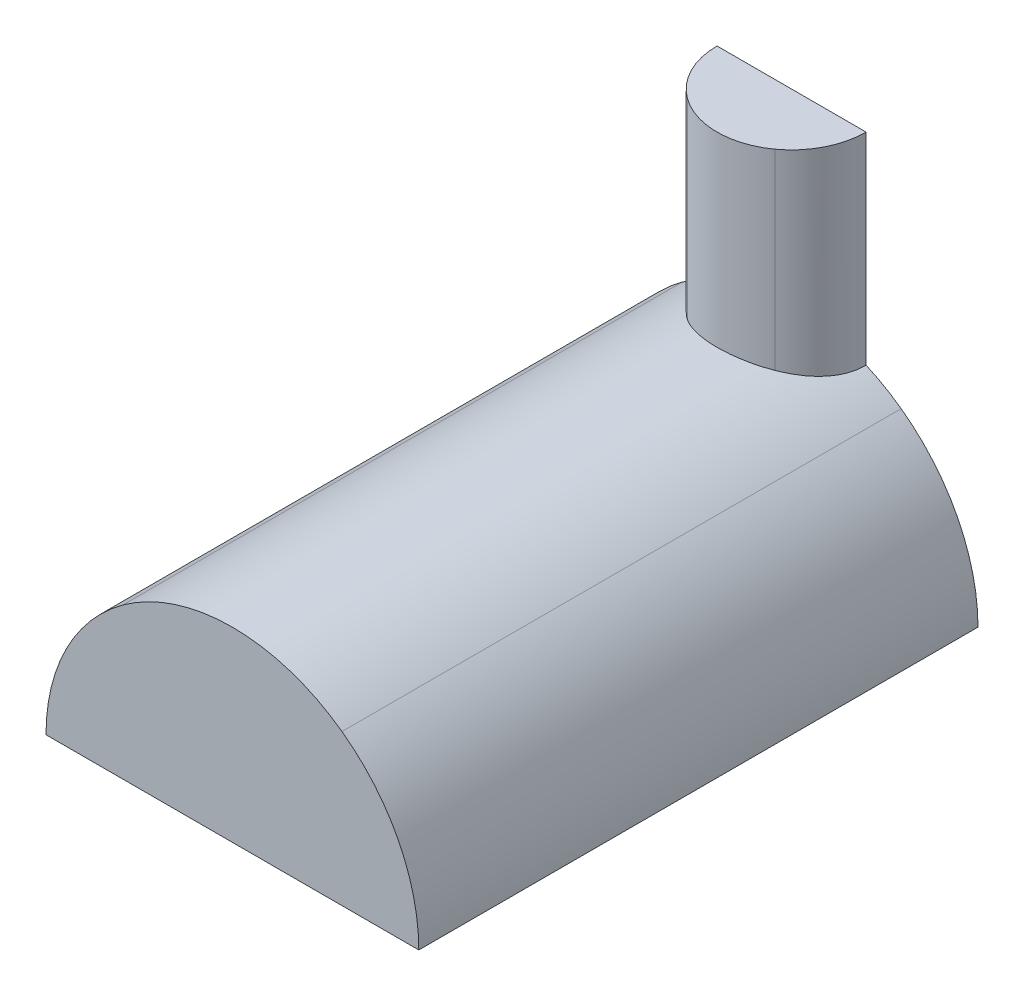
SolidWorks part; units mm, degrees
ref_plane "Front Plane" through (0, 0, 0) normal (0, 0, 1) x (1, 0, 0)
ref_plane "Top Plane" through (0, 0, 0) normal (0, 1, 0) x (1, 0, 0)
ref_plane "Right Plane" through (0, 0, 0) normal (1, 0, 0) x (0, 0, -1)
sketch "Sketch1" plane through (0, 0, 0) normal (0, 0, 1) x (1, 0, 0)
  line L0 (-1270, 0) -> (1270, 0)
  arc A0 (1270, 0) -> (-1270, 0) centre (0, 0) ccw
  dimension "D1" = 2540
extrude "Boss-Extrude1" add sketch "Sketch1" along normal blind 3810
sketch "Sketch2" plane through (0, 0, 0) normal (0, -1, 0) x (1, 0, 0)
  line L0 (-1270, 0) -> (1270, 0) construction
  line L1 (508, 0) -> (-508, 0)
  arc A0 (508, 0) -> (-508, 0) centre (0, 0) ccw
  dimension "D1" = 508
extrude "Boss-Extrude2" add sketch "Sketch2" against normal blind 2540
sketch "Sketch3" plane through (0, 0, 0) normal (0, -1, 0) x (1, 0, 0)
  line L0 (-1270, 0) -> (1270, 0) construction
  line L1 (-1270, 3810) -> (-1270, 0) construction
  circle A0 centre (0, 1905) radius 317.5
  dimension "D3" = 635
  dimension "D1" = 1905
  dimension "D2" = 1270
extrude "Cut-Extrude1" [suppressed] cut sketch "Sketch3" against normal through all
ref_point "Point1" parameters "D1"=1196.9468
ref_point "Point2" parameters "D1"=2792.8759
ref_plane "Plane2" through (-746.4873, 0, 0) normal (1, 0, 0) x (0, 0, -1)
ref_plane "Plane3" through (746.4873, 0, 0) normal (1, 0, 0) x (0, 0, -1)
ref_point "Point3"
ref_point "Point4" parameters "D1"=478.7787
ref_plane "Plane4" through (-298.5949, 0, 0) normal (1, 0, 0) x (0, 0, -1)
ref_plane "Plane5" through (298.5949, 0, 0) normal (1, 0, 0) x (0, 0, -1)
